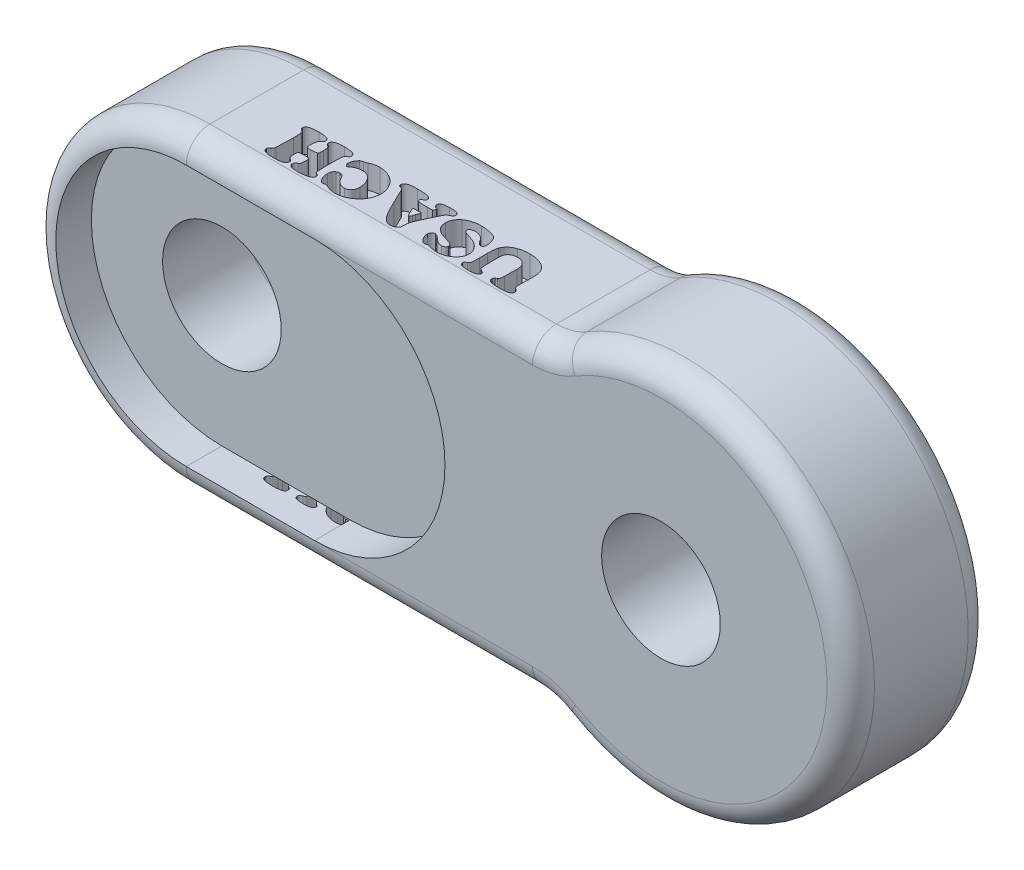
SolidWorks part; units mm, degrees
ref_plane "Alzado" through (0, 0, 0) normal (0, 0, 1) x (1, 0, 0)
ref_plane "Planta" through (0, 0, 0) normal (0, 1, 0) x (1, 0, 0)
ref_plane "Vista lateral" through (0, 0, 0) normal (1, 0, 0) x (0, 0, -1)
sketch "Croquis1" plane through (0, 0, 0) normal (0, 0, 1) x (1, 0, 0)
  line L0 (0, 65) -> (145.9167, 65)
  line L1 (0, -65) -> (145.9167, -65)
  line L2 (0, 0) -> (200, 0) construction
  arc A0 (0, 65) -> (0, -65) centre (0, 0) ccw
  circle A1 centre (0, 0) radius 25
  arc A2 (158.7937, -68.5714) -> (158.7937, 68.5714) centre (200, 0) ccw
  circle A3 centre (200, 0) radius 25
  arc A4 (145.9167, -65) -> (158.7937, -68.5714) centre (145.9167, -90) cw
  arc A5 (145.9167, 65) -> (158.7937, 68.5714) centre (145.9167, 90) ccw
  dimension "D1" = 130
  dimension "D2" = 50
  dimension "D3" = 160
  dimension "D4" = 50
  dimension "D6" = 25
  dimension "D5" = 200
extrude "Saliente-Extruir1" add sketch "Croquis1" along normal blind 59.5
sketch "Croquis2" plane through (0, -65, 0) normal (0, -1, 0) x (1, 0, 0)
  line L0 (0, 29.75) -> (145.9167, 29.75) construction
  line L1 (0, 59.5) -> (0, 0) construction
  line L2 (145.9167, 59.5) -> (145.9167, 0) construction
  line L3 (72.9584, 0) -> (72.9584, 59.5) construction
  line L4 (0, 0) -> (145.9167, 0) construction
  line L5 (0, 59.5) -> (145.9167, 59.5) construction
  text T0 "USACH" font "Cooper Black" height in points 80
extrude "Cortar-Extruir1" cut sketch "Croquis2" against normal blind 10
sketch "Croquis3" plane through (0, 65, 0) normal (0, 1, 0) x (1, 0, 0)
  line L0 (0, -29.75) -> (145.9167, -29.75) construction
  line L1 (0, -59.5) -> (0, 0) construction
  line L2 (145.9167, -59.5) -> (145.9167, 0) construction
  line L3 (72.9584, -59.5) -> (72.9584, 0) construction
  line L4 (145.9167, -59.5) -> (0, -59.5) construction
  line L5 (145.9167, 0) -> (0, 0) construction
  text T0 "USACH" font "Cooper Black" height in points 80
extrude "Cortar-Extruir2" cut sketch "Croquis3" against normal blind 10
fillet "Redondeo1" radius 10 14 edges at (152.5983, 65.9094, 59.5) (280, 0, 59.5) (152.5983, -65.9094, 59.5) (72.9584, -65, 59.5) (-65, 0, 59.5) (225, 0, 0) (280, 0, 0) (152.5983, 65.9094, 0) (72.9584, 65, 0) (-65, 0, 0) (72.9584, -65, 0) (152.5983, -65.9094, 0) (25, 0, 0) (72.9584, 65, 59.5)
sketch "Croquis5" plane through (0, 0, 59.5) normal (0, 0, 1) x (1, 0, 0)
  line L0 (145.9167, 55) -> (0, 55) construction
  line L1 (54, 55) -> (0, 55)
  line L2 (0, -55) -> (145.9167, -55) construction
  line L3 (0, -55) -> (54, -55)
  line L4 (0, 55) -> (0, -55) construction
  line L5 (0, 0) -> (175, 0) construction
  line L6 (27, 55) -> (27, -55) construction
  arc A0 (0, 55) -> (0, -55) centre (0, 0) ccw construction
  arc A1 (0, 55) -> (0, -55) centre (0, 0) ccw
  circle A2 centre (200, 0) radius 25 construction
  arc A5 (54, 55) -> (54, -55) centre (54, 0) cw
  point P5 (109, 0)
  dimension "D1" = 82
extrude "Cortar-Extruir3" cut sketch "Croquis5" against normal blind 15 contours L3 A5 L1 A1
sketch "Croquis6" plane through (0, 0, 0) normal (0, 0, -1) x (-1, 0, 0)
  line L0 (-200, 0) -> (-146, 0) construction
  line L1 (-200, 55) -> (-146, 55)
  line L2 (-200, -55) -> (-146, -55)
  arc A0 (-200, 55) -> (-200, -55) centre (-200, 0) ccw
  arc A1 (-146, -55) -> (-146, 55) centre (-146, 0) ccw
  dimension "D1" = 110
  dimension "D3" = 110
  dimension "D2" = 54
extrude "Cortar-Extruir4" cut sketch "Croquis6" against normal blind 15
